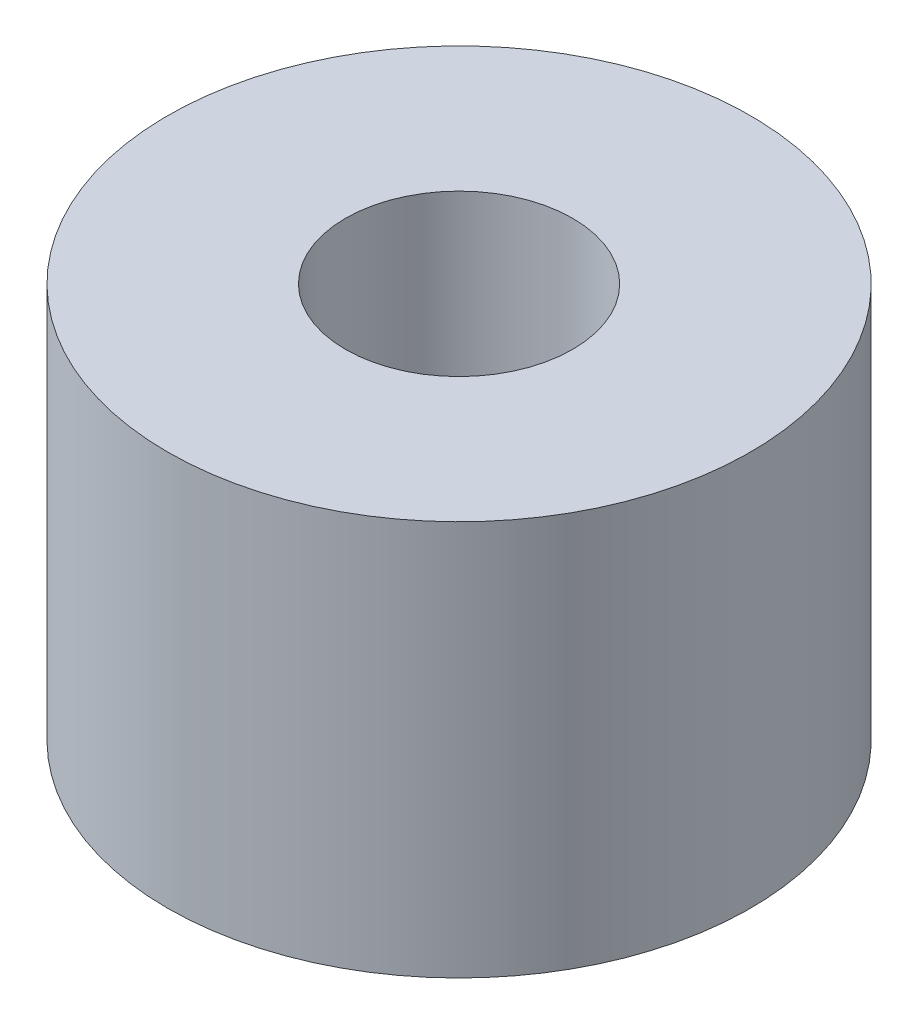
SolidWorks part; units mm, degrees
ref_plane "Front" through (0, 0, 0) normal (0, 0, 1) x (1, 0, 0)
ref_plane "Top" through (0, 0, 0) normal (0, 1, 0) x (1, 0, 0)
ref_plane "Right" through (0, 0, 0) normal (1, 0, 0) x (0, 0, -1)
sketch "Sketch1" plane through (0, 0, 0) normal (0, 1, 0) x (1, 0, 0)
  circle A0 centre (0, 0) radius 2.95
  circle A1 centre (0, 0) radius 1.15
  dimension "D1" = 5.9
  dimension "D2" = 1.8
extrude "Boss-Extrude1" add sketch "Sketch1" along normal blind 4
